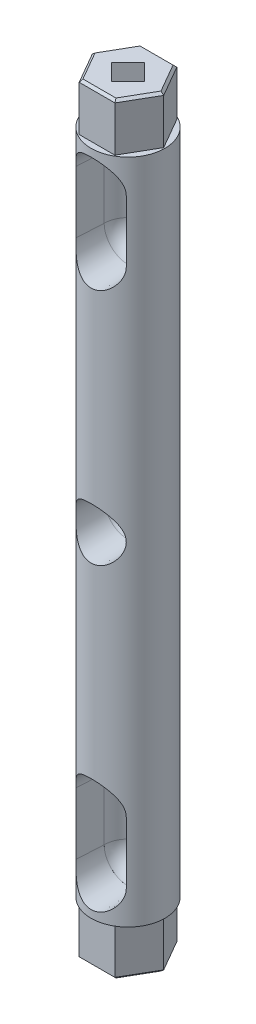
SolidWorks part; units mm, degrees
ref_plane "Front Plane" through (0, 0, 0) normal (0, 0, 1) x (1, 0, 0)
ref_plane "Top Plane" through (0, 0, 0) normal (0, 1, 0) x (1, 0, 0)
ref_plane "Right Plane" through (0, 0, 0) normal (1, 0, 0) x (0, 0, -1)
sketch "Sketch1" plane through (0, 0, 0) normal (0, 1, 0) x (1, 0, 0)
  circle A0 centre (0, 0) radius 7.75
extrude "Boss-Extrude1" add sketch "Sketch1" along normal blind 140
sketch "Sketch2" plane through (0, 0, 0) normal (0, 0, 1) x (1, 0, 0)
  line L0 (0, 140) -> (0, 133) construction
  line L1 (7.75, 140) -> (-7.75, 140) construction
  line L2 (0, 140) -> (0, 0) construction
  line L3 (7.75, 70) -> (-7.75, 70) construction
  line L4 (0, 133) -> (0, 121) construction
  line L5 (-5, 133) -> (-5, 121)
  line L6 (5, 133) -> (5, 121)
  line L7 (7.75, 0) -> (7.75, 140) construction
  line L8 (0, 19) -> (0, 20) construction
  line L9 (0, 7) -> (0, 19) construction
  line L10 (0, 121) -> (0, 120) construction
  line L11 (5, 121) -> (5, 120)
  line L12 (-5, 121) -> (-5, 120)
  line L13 (-7.75, 140) -> (-7.75, 0) construction
  line L14 (-5, 19) -> (-5, 20)
  line L15 (5, 19) -> (5, 20)
  line L16 (5, 7) -> (5, 19)
  line L17 (-5, 7) -> (-5, 19)
  arc A0 (5, 133) -> (-5, 133) centre (0, 133) ccw
  circle A1 centre (0, 70) radius 5
  arc A2 (-5, 20) -> (5, 20) centre (0, 20) cw
  arc A3 (5, 7) -> (-5, 7) centre (0, 7) cw
  arc A5 (-5, 120) -> (5, 120) centre (0, 120) ccw
  dimension "D1" = 12
  dimension "D2" = 1
  dimension "D4" = 7
extrude "Cut-Extrude1" cut sketch "Sketch2" along normal through all draft 3
ref_axis "Axis1" through (0, 140, 0) along (0, -1, 0)
sketch "Sketch3" plane through (0, 0, 0) normal (0, 0, 1) x (1, 0, 0)
  line L0 (0.0046, 11) -> (0.0046, 2.0109)
  line L1 (0, 75) -> (0, 65)
  line L2 (0, 138) -> (0, 130)
  line L3 (0, 133) -> (0, 120) construction
  line L4 (5, 133) -> (5, 120)
  line L5 (0, 130) -> (0, 115)
  line L6 (0.0046, 11) -> (0.0046, 24.9954)
  line L7 (5, 20) -> (5, 7)
  line L8 (-5, 120.66) -> (5, 120.66) construction
  line L9 (-5, 20) -> (5, 20) construction
  line L10 (-5, 120) -> (5, 120) construction
  line L11 (-5, 20) -> (5, 20) construction
  line L12 (5.2965, 7) -> (5, 7) construction
  line L13 (5, 120) -> (5, 133) construction
  arc A0 (5, 133) -> (0, 138) centre (0, 133) ccw
  arc A1 (0, 65) -> (0, 75) centre (0, 70) ccw
  arc A2 (0.0046, 2.0109) -> (5, 7) centre (0.0046, 7.0063) ccw
  arc A3 (0, 115) -> (5, 120) centre (0, 120) ccw
  arc A4 (5, 20) -> (0.0046, 24.9954) centre (0.0046, 20) ccw
revolve "Cut-Revolve1" cut sketch "Sketch3" angle 360 about axis through (0, 140, 0) along (0, -1, 0)
sketch "Sketch4" plane through (0, 140, 0) normal (0, 1, 0) x (1, 0, 0)
  line L1 (7.5, 0) -> (3.75, 6.4952)
  line L2 (3.75, 6.4952) -> (-3.75, 6.4952)
  line L3 (-3.75, 6.4952) -> (-7.5, 0)
  line L4 (-7.5, 0) -> (-3.75, -6.4952)
  line L5 (-3.75, -6.4952) -> (3.75, -6.4952)
  line L6 (3.75, -6.4952) -> (7.5, 0)
  circle A0 centre (0, 0) radius 6.4952 construction
extrude "Boss-Extrude2" add sketch "Sketch4" along normal blind 10
sketch "Sketch5" plane through (0, 0, 0) normal (0, -1, 0) x (-1, 0, 0)
  line L1 (-7.5, 0) -> (-3.75, -6.4952)
  line L2 (-3.75, -6.4952) -> (3.75, -6.4952)
  line L3 (3.75, -6.4952) -> (7.5, 0)
  line L4 (7.5, 0) -> (3.75, 6.4952)
  line L5 (3.75, 6.4952) -> (-3.75, 6.4952)
  line L6 (-3.75, 6.4952) -> (-7.5, 0)
  circle A0 centre (0, 0) radius 6.4952 construction
extrude "Boss-Extrude3" add sketch "Sketch5" along normal blind 10
hole_wizard "#10 (0.1935) Diameter Hole1" positions "Sketch7" profile "Sketch6" hole size "#10" standard "ANSI Inch"
sketch "Sketch7" plane through (0, 150, 0) normal (0, 1, 0) x (1, 0, 0)
  point P0 (0, 0)
sketch "Sketch6" plane through (0, 150, 0) normal (1, 0, 0) x (0, 0, 1)
  line L0 (0, 0) -> (0, 6.4766)
  line L1 (0, 6.4766) -> (2.4574, 5)
  line L2 (2.4574, 5) -> (2.4574, 0)
  line L5 (2.4574, 0) -> (0, 0)
  line L10 (0, 6.4766) -> (-2.4574, 5) construction
  line L11 (0, -6.35) -> (0, 107.95) construction
  dimension "Hole Dia." = 4.9149
  dimension "Hole Depth" = 5
  dimension "Drill Angle" = 118
hole_wizard "#10 (0.1935) Diameter Hole2" positions "Sketch10" profile "Sketch9" hole size "#10" standard "ANSI Inch"
sketch "Sketch10" plane through (0, -10, 0) normal (0, -1, 0) x (-1, 0, 0)
  point P0 (0, 0)
sketch "Sketch9" plane through (0, -10, 0) normal (1, 0, 0) x (0, 0, -1)
  line L0 (0, 0) -> (0, 6.4766)
  line L1 (0, 6.4766) -> (2.4574, 5)
  line L2 (2.4574, 5) -> (2.4574, 0)
  line L5 (2.4574, 0) -> (0, 0)
  line L10 (0, 6.4766) -> (-2.4574, 5) construction
  line L11 (0, -6.35) -> (0, 107.95) construction
  dimension "Hole Dia." = 4.9149
  dimension "Hole Depth" = 5
  dimension "Drill Angle" = 118
sketch "Sketch11" plane through (0, 150, 0) normal (0, 1, 0) x (1, 0, 0)
  line L0 (0, 4.4419) -> (0, -4.4225) construction
  line L1 (-4.1212, 0) -> (4.1989, 0) construction
  line L2 (0, 3.4876) -> (3.4876, 0) construction
  line L3 (0, 3.4876) -> (3.4876, 0)
  line L4 (3.4876, 0) -> (0, -3.4876)
  line L5 (0, -3.4876) -> (-3.4876, 0)
  line L6 (-3.4876, 0) -> (0, 3.4876)
  circle A0 centre (0, 0) radius 2.4574 construction
extrude "Cut-Extrude2" cut sketch "Sketch11" against normal blind 10
sketch "Sketch12" plane through (0, -10, 0) normal (0, -1, 0) x (-1, 0, 0)
  line L0 (0, -3.4876) -> (-3.4876, 0)
  line L1 (-3.4876, 0) -> (0, 3.4876)
  line L2 (0, 3.4876) -> (3.4876, 0)
  line L3 (3.4876, 0) -> (0, -3.4876)
extrude "Cut-Extrude3" cut sketch "Sketch12" against normal blind 10
chamfer "Chamfer1" distance 0.5 angle 45 6 edges at (0, 150, 6.4952) (-5.625, 150, 3.2476) (-5.625, 150, -3.2476) (0, 150, -6.4952) (5.625, 150, -3.2476) (5.625, 150, 3.2476)
chamfer "Chamfer2" distance 0.5 angle 45 6 edges at (-5.625, -10, 3.2476) (-5.625, -10, -3.2476) (0, -10, -6.4952) (5.625, -10, -3.2476) (5.625, -10, 3.2476) (0, -10, 6.4952)
